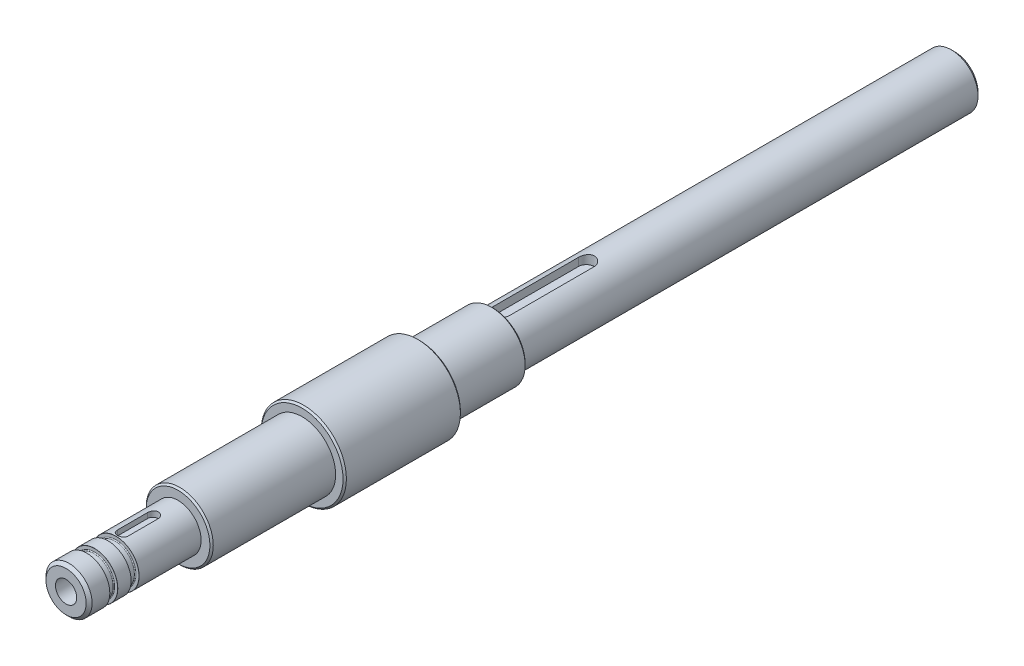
SolidWorks part; units mm, degrees
ref_plane "Front Plane" through (0, 0, 0) normal (0, 0, 1) x (1, 0, 0)
ref_plane "Top Plane" through (0, 0, 0) normal (0, 1, 0) x (1, 0, 0)
ref_plane "Right Plane" through (0, 0, 0) normal (1, 0, 0) x (0, 0, -1)
sketch "Sketch1" plane through (0, 0, 0) normal (0, 0, 1) x (1, 0, 0)
  circle A0 centre (0, 0) radius 12.7
  dimension "D1" = 25.4
extrude "Boss-Extrude1" add sketch "Sketch1" along normal blind 150 and the other way blind 115
ref_plane "Plane1" through (0, 0, 143.65) normal (0, 0, 1) x (1, 0, 0)
ref_plane "Plane2" through (0, 0, 137.3) normal (0, 0, 1) x (1, 0, 0)
sketch "Sketch2" plane through (0, 0, 150) normal (0, 0, 1) x (1, 0, 0)
  circle A0 centre (0, 0) radius 3.175
  dimension "D1" = 6.35
extrude "Cut-Extrude1" cut sketch "Sketch2" against normal through all
sketch "Sketch3" plane through (0, 0, 150) normal (0, 0, 1) x (1, 0, 0)
  circle A0 centre (0, 0) radius 7
  dimension "D1" = 14
extrude "Cut-Extrude2" cut sketch "Sketch3" against normal blind 70.39 flip side to cut
sketch "Sketch4" plane through (0, 0, 79.61) normal (0, 0, 1) x (1, 0, 0)
  circle A0 centre (0, 0) radius 10
  circle A1 centre (0, 0) radius 6.35
  dimension "D1" = 20
extrude "Boss-Extrude2" add sketch "Sketch4" along normal blind 37
ref_plane "Plane3" through (0, 0, 44.61) normal (0, 0, 1) x (1, 0, 0)
sketch "Sketch5" plane through (0, 0, 44.61) normal (0, 0, 1) x (1, 0, 0)
  circle A0 centre (0, 0) radius 10
  dimension "D1" = 20
extrude "Cut-Extrude3" cut sketch "Sketch5" against normal through all flip side to cut
ref_plane "Plane4" through (0, 0, 22.61) normal (0, 0, 1) x (1, 0, 0)
sketch "Sketch6" plane through (0, 0, 22.61) normal (0, 0, 1) x (1, 0, 0)
  circle A0 centre (0, 0) radius 7.9375
  dimension "D1" = 15.875
extrude "Cut-Extrude4" cut sketch "Sketch6" against normal through all flip side to cut
chamfer "Chamfer1" distance 1 angle 45 2 edges at (7, 0, 150) (7.9375, 0, -115)
chamfer "Chamfer2" distance 0.5 angle 45 4 edges at (10, 0, 22.61) (12.7, 0, 44.61) (12.7, 0, 79.61) (10, 0, 116.61)
sketch "Sketch8" plane through (0, 0, 0) normal (0, 1, 0) x (1, 0, 0)
  line L0 (7, -149) -> (7, -116.61) construction
  line L1 (5.9714, -141.4689) -> (8.2826, -141.4689)
  line L2 (5.7174, -141.7229) -> (5.7174, -143.5771)
  line L3 (5.9714, -143.8311) -> (8.2826, -143.8311)
  line L4 (8.2826, -141.4689) -> (8.2826, -143.8311)
  line L5 (5.7174, -141.4689) -> (8.2826, -143.8311) construction
  line L6 (5.7174, -143.8311) -> (8.2826, -141.4689) construction
  line L7 (5.9714, -135.1189) -> (8.2826, -135.1189)
  line L8 (5.7174, -135.3729) -> (5.7174, -137.2271)
  line L9 (5.9714, -137.4811) -> (8.2826, -137.4811)
  line L10 (8.2826, -135.1189) -> (8.2826, -137.4811)
  line L11 (5.7174, -135.1189) -> (8.2826, -137.4811) construction
  line L12 (5.7174, -137.4811) -> (8.2826, -135.1189) construction
  line L13 (7, -142.65) -> (7, -136.3) construction
  arc A0 (5.7174, -143.5771) -> (5.9714, -143.8311) centre (5.9714, -143.5771) ccw
  arc A1 (5.7174, -141.7229) -> (5.9714, -141.4689) centre (5.9714, -141.7229) cw
  arc A2 (5.7174, -137.2271) -> (5.9714, -137.4811) centre (5.9714, -137.2271) ccw
  arc A3 (5.7174, -135.3729) -> (5.9714, -135.1189) centre (5.9714, -135.3729) cw
  point P0 (7, -142.65)
  point P15 (7, -136.3)
  dimension "D4" = 0.254
  dimension "D1" = 2.5652
  dimension "D2" = 2.3622
  dimension "D3" = 6.35
  dimension "D6" = 6.35
  dimension "D5" = 2
ref_axis "Axis1" through (0, 0, -115) along (0, 0, 1)
revolve "Cut-Revolve1" cut sketch "Sketch8" angle 360 about axis through (0, 0, -115) along (0, 0, 1)
fillet "Fillet1" radius 0.1778 4 edges at (-7, 0, 143.8311) (7, 0, 141.4689) (-7, 0, 137.4811) (7, 0, 135.1189)
sketch "Sketch9" plane through (0, 0, 150) normal (0, 0, 1) x (1, 0, 0)
  circle A0 centre (0, 0) radius 6.8834
  dimension "D1" = 13.7668
extrude "Cut-Extrude5" cut sketch "Sketch9" against normal up to surface (33.39 mm away) flip side to cut
ref_plane "Plane5" through (0, 7.9375, 0) normal (0, 1, 0) x (-1, 0, 0)
sketch "Sketch10" plane through (0, 7.9375, 0) normal (0, 1, 0) x (-1, 0, 0)
  line L0 (-7.9375, 22.61) -> (7.9375, 22.61) construction
  line L1 (-2.3813, 20.2287) -> (-2.3812, -5.1713)
  line L2 (2.3813, 20.2287) -> (2.3812, -5.1713)
  arc A0 (2.3813, 20.2287) -> (-2.3813, 20.2287) centre (0, 20.2287) ccw
  arc A1 (-2.3812, -5.1713) -> (2.3812, -5.1713) centre (0, -5.1713) ccw
  dimension "D1" = 2.3813
  dimension "D2" = 25.4
extrude "Cut-Extrude6" cut sketch "Sketch10" against normal blind 2.7468
ref_plane "Plane6" through (0, 6.8834, 0) normal (0, 1, 0) x (-1, 0, 0)
sketch "Sketch11" plane through (0, 6.8834, 0) normal (0, 1, 0) x (-1, 0, 0)
  line L0 (6.8834, 135.108) -> (-6.8834, 135.108) construction
  line L1 (-1.5875, 133.108) -> (-1.5875, 124.108)
  line L2 (1.5875, 133.108) -> (1.5875, 124.108)
  arc A0 (1.5875, 133.108) -> (-1.5875, 133.108) centre (0, 133.108) ccw
  arc A1 (-1.5875, 124.108) -> (1.5875, 124.108) centre (0, 124.108) ccw
  dimension "D1" = 2
  dimension "D2" = 9
extrude "Cut-Extrude7" cut sketch "Sketch11" against normal blind 1.75
